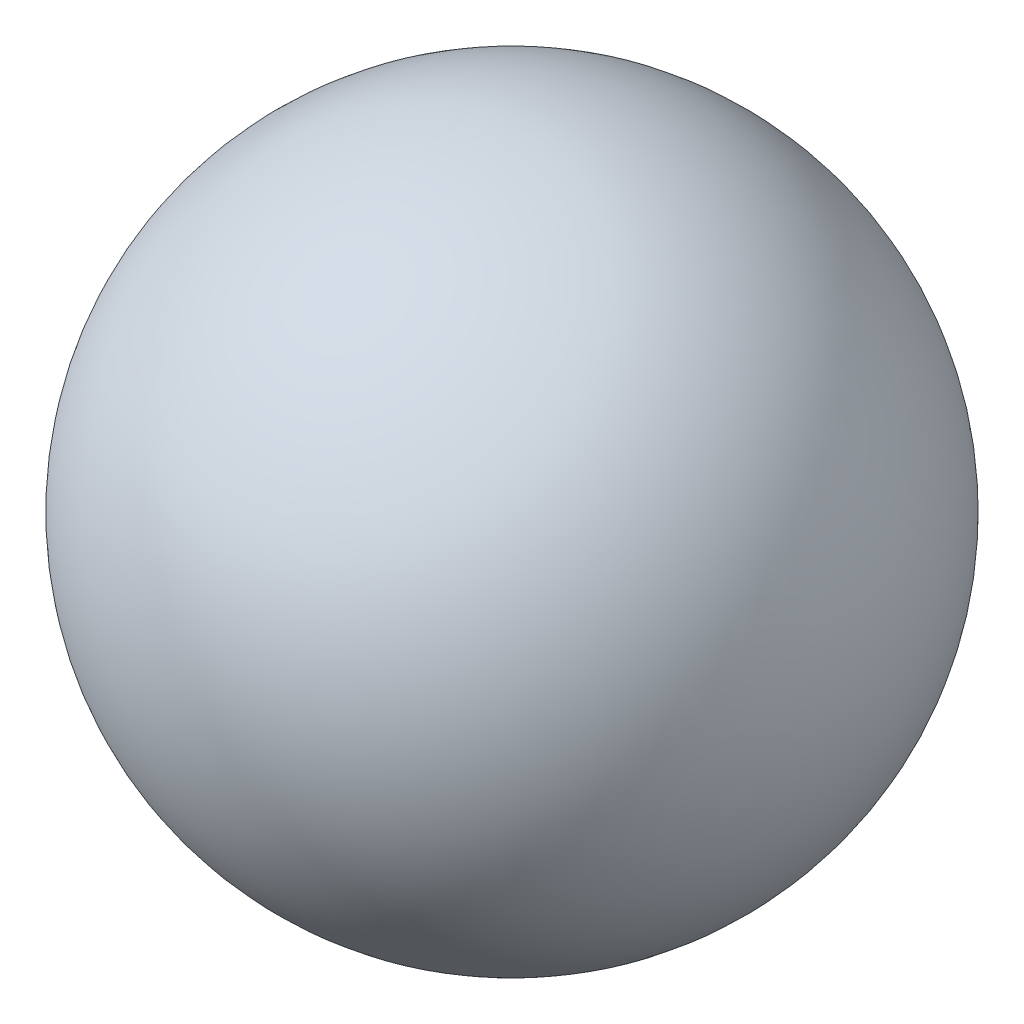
SolidWorks part; units mm, degrees
ref_plane "Front" through (0, 0, 0) normal (0, 0, 1) x (1, 0, 0)
ref_plane "Top" through (0, 0, 0) normal (0, 1, 0) x (1, 0, 0)
ref_plane "Right" through (0, 0, 0) normal (1, 0, 0) x (0, 0, -1)
sketch "Sketch1" plane through (0, 0, 0) normal (0, 0, 1) x (1, 0, 0)
  line L0 (0, 0) -> (0, 3.175)
  arc A0 (0, 0) -> (0, 3.175) centre (0, 1.5875) ccw
  point P4 (-2.7859, 1.2056)
  point P5 (0, 1.5875)
  dimension "D1" = 3.175
revolve "Revolve1" add sketch "Sketch1" angle 360 about L0
sketch "Sketch2" plane through (0, 0, 0) normal (1, 0, 0) x (0, 0, -1)
  point P0 (0, 1.5875)
  dimension "D1" = 1.5875
